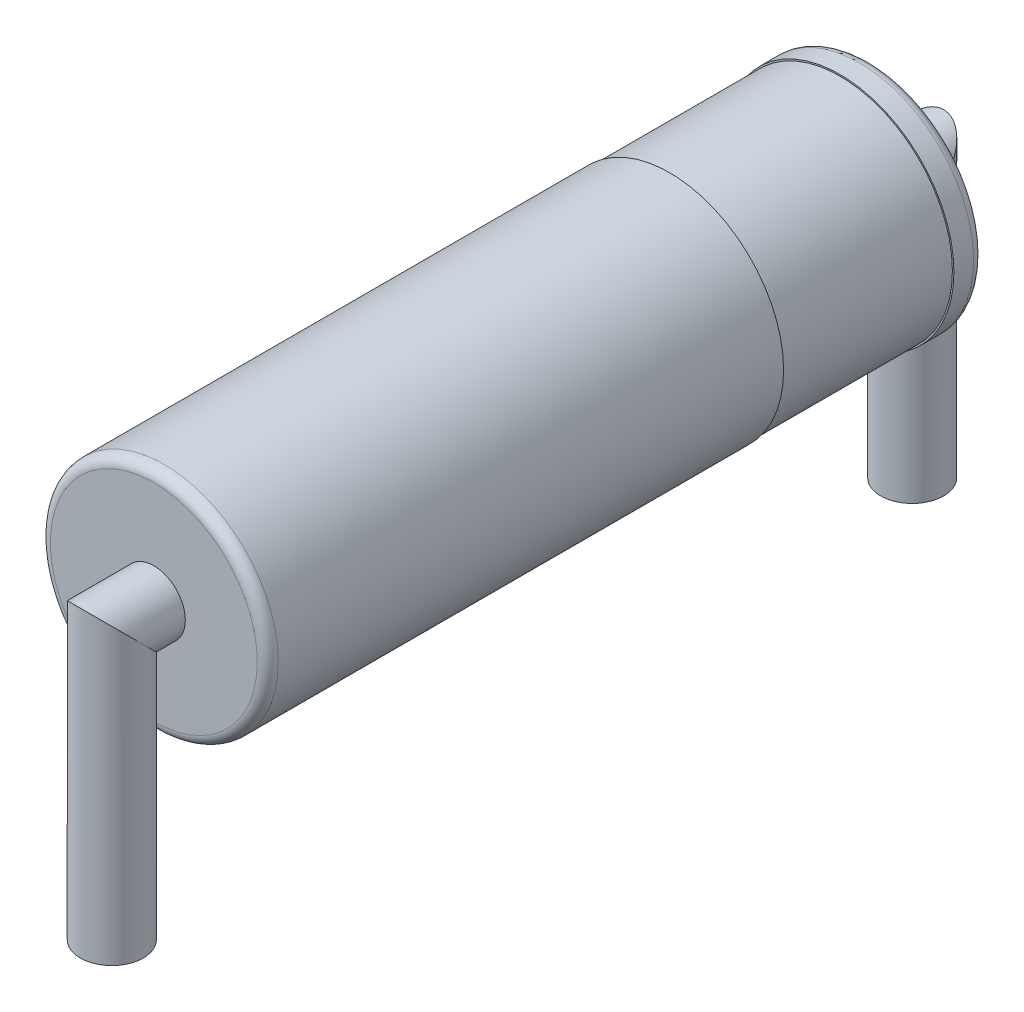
SolidWorks part; units mm, degrees
ref_plane "Plan de face" through (0, 0, 0) normal (0, 0, 1) x (1, 0, 0)
ref_plane "Plan de dessus" through (0, 0, 0) normal (0, 1, 0) x (1, 0, 0)
ref_plane "Plan de droite" through (0, 0, 0) normal (1, 0, 0) x (0, 0, -1)
sketch "Esquisse1" plane through (0, 0, 0) normal (0, 0, 1) x (1, 0, 0)
  circle A0 centre (0, 0) radius 1.085
  dimension "D1" = 2.17
extrude "Extrusion1" add sketch "Esquisse1" along normal mid plane 6.82
fillet "Congé1" radius 0.1 2 edges at (1.085, 0, 3.41) (1.085, 0, -3.41)
sketch "Esquisse2" plane through (0, 0, -3.41) normal (0, 0, -1) x (-1, 0, 0)
  circle A0 centre (0, 0) radius 0.3
sketch "Esquisse3" plane through (0, 0, 0) normal (1, 0, 0) x (0, 0, -1)
  line L0 (3.41, 0) -> (3.81, 0)
  line L1 (3.41, -0.3) -> (3.41, 0.3) construction
  line L2 (0, 3.3062) -> (0, -4.9544) construction
  line L3 (-8.8413, 0) -> (13.4938, 0) construction
  line L4 (3.81, 2.5036) -> (3.81, -4.9544) construction
  line L5 (-9.9571, -2.585) -> (11.2035, -2.585) construction
  line L6 (7.7975, -1.085) -> (4.1565, -1.085) construction
  line L7 (3.81, 0) -> (3.81, -2.585)
  dimension "D1" = 3.81
  dimension "D2" = 1.5
sweep "Balayage1" add profiles "Esquisse2" path "Esquisse3"
mirror "Symétrie1" about plane through (0, 0, 0) normal (0, 0, 1) of "Balayage1"
sketch "Esquisse4" plane through (0, 0, 0) normal (1, 0, 0) x (0, 0, -1)
  line L0 (0, 0) -> (3.1219, 0) construction
  line L3 (3.1219, 1.1535) -> (1.5008, 1.1535)
  line L4 (3.1219, 1.1535) -> (3.1219, 1.0709)
  line L5 (3.1219, 1.0709) -> (1.5008, 1.0709)
  line L6 (1.5008, 1.1535) -> (1.5008, 1.0709)
revolve "Enlèvement de matière-Révolution1" cut sketch "Esquisse4" angle 360 about L0
